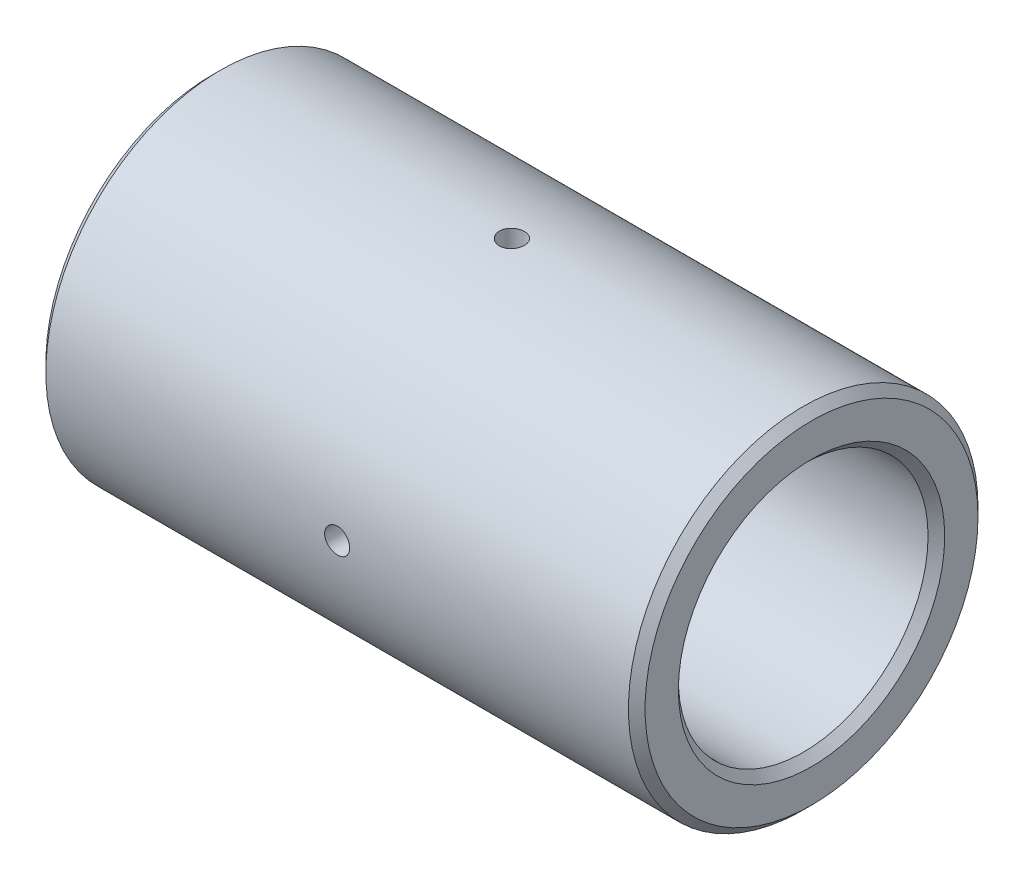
SolidWorks part; units mm, degrees
ref_plane "Front Plane" through (0, 0, 0) normal (0, 0, 1) x (1, 0, 0)
ref_plane "Top Plane" through (0, 0, 0) normal (0, 1, 0) x (1, 0, 0)
ref_plane "Right Plane" through (0, 0, 0) normal (1, 0, 0) x (0, 0, -1)
sketch "Sketch1" plane through (0, 0, 0) normal (0, 0, 1) x (1, 0, 0)
  line L0 (0, 16) -> (0, 20)
  line L1 (1, 21) -> (71, 21)
  line L2 (72, 20) -> (72, 16)
  line L3 (71, 15) -> (37.5, 15)
  line L4 (37.5, 15) -> (37.5, 17)
  line L5 (37.5, 17) -> (34.5, 17)
  line L6 (34.5, 17) -> (34.5, 15)
  line L7 (34.5, 15) -> (1, 15)
  line L8 (1, 15) -> (0, 16)
  line L9 (72, 16) -> (71, 15)
  line L10 (71, 21) -> (72, 20)
  line L11 (0, 20) -> (1, 21)
  point P0 (0, 15)
  point P1 (0, 21)
  point P3 (72, 21)
  point P4 (72, 15)
  point P9 (36, 17)
  point P18 (36, 21)
  dimension "D1" = 15
  dimension "D2" = 21
  dimension "D3" = 17
  dimension "D4" = 3
  dimension "D5" = 36
ref_axis "Axis1" through (94.5, 0, 0) along (-1, 0, 0)
revolve "Revolve1" add sketch "Sketch1" angle 360 about axis through (94.5, 0, 0) along (-1, 0, 0)
hole_wizard "Ø3.0mm Dowel Hole1" positions "3DSketch1" profile "Sketch2" hole size "Ø3.0" standard "ISO"
sketch3d "3DSketch1"
  point P0 (36, -21, 0)
  dimension "D1" = 36
sketch "Sketch2" plane through (36, -21, 0) normal (1, 0, 0) x (0, 0, -1)
  line L0 (0, 0) -> (0, 4)
  line L1 (0, 4) -> (1.5, 4)
  line L2 (1.5, 4) -> (1.5, 0)
  line L5 (1.5, 0) -> (0, 0)
  line L11 (0, -6.35) -> (0, 107.95) construction
  dimension "Thru Hole Dia." = 3
  dimension "Thru Hole Depth" = 4
pattern_circular "CirPattern1" count 4 over 360 about axis through (94.5, 0, 0) along (1, 0, 0) of "Ø3.0mm Dowel Hole1"
